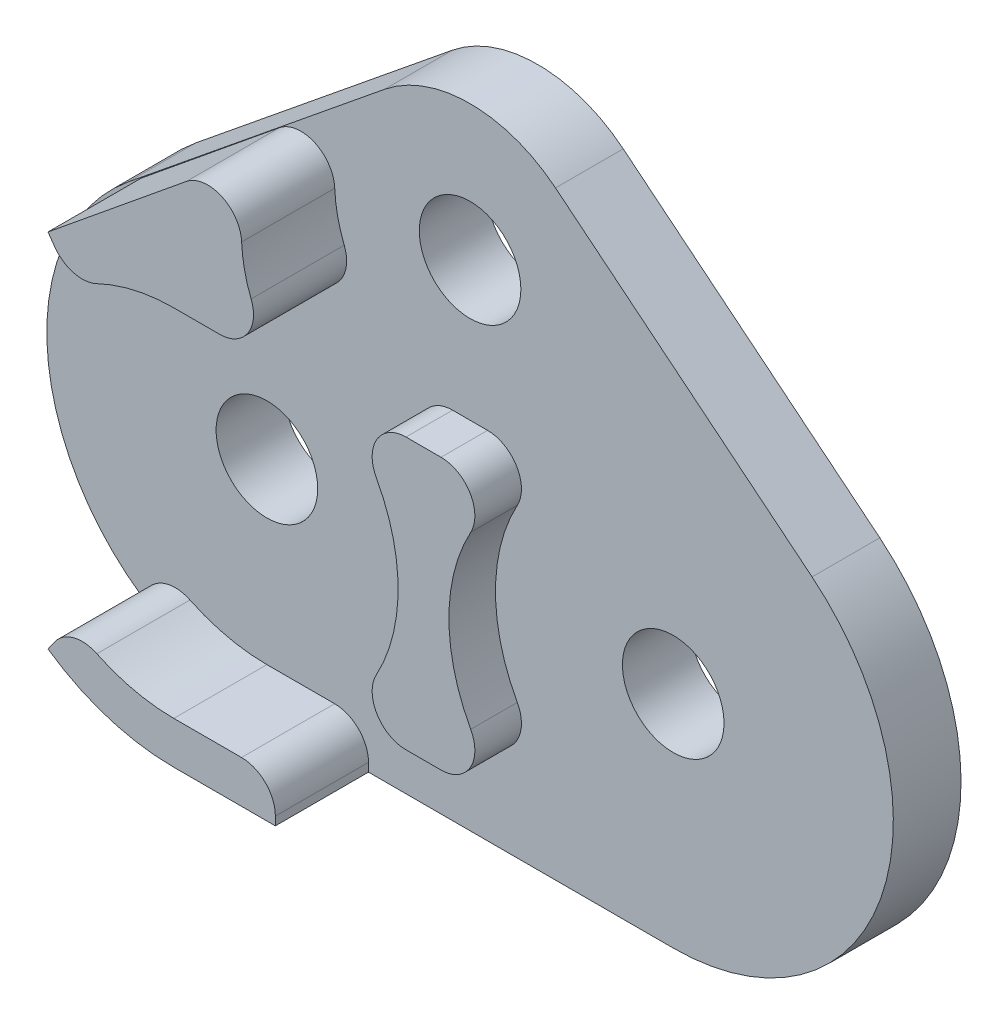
SolidWorks part; units mm, degrees
ref_plane "Front Plane" through (0, 0, 0) normal (0, 0, 1) x (1, 0, 0)
ref_plane "Top Plane" through (0, 0, 0) normal (0, 1, 0) x (1, 0, 0)
ref_plane "Right Plane" through (0, 0, 0) normal (1, 0, 0) x (0, 0, -1)
sketch "Sketch1" plane through (0, 0, 0) normal (0, 0, 1) x (1, 0, 0)
  line L0 (0, 0) -> (0, 6.801) construction
  line L1 (12.5, 0) -> (-12.5, 0) construction
  line L2 (-6, 6.5) -> (-6, -6.5) construction
  line L3 (-6, 6.5) -> (6, 6.5)
  line L4 (-6, -6.5) -> (6, -6.5)
  line L5 (6, 6.5) -> (6, -6.5) construction
  arc A0 (-6, 6.5) -> (-6, -6.5) centre (-6, 0) ccw
  arc A1 (6, 6.5) -> (6, -6.5) centre (6, 0) cw
  point P9 (0, 6.5)
  point P13 (0, -6.5)
  dimension "D2" = 6.5
  dimension "D1" = 12.5
  dimension "D3" = 6.5
extrude "Base" add sketch "Sketch1" along normal blind 2
sketch "Sketch2" plane through (0, 0, 2) normal (0, 0, 1) x (1, 0, 0)
  line L0 (-12.5, 0) -> (12.5, 0) construction
  line L1 (-6, 6.5) -> (-6, -6.5) construction
  line L2 (6, 6.5) -> (6, -6.5) construction
  arc A0 (-6, 6.5) -> (-6, -6.5) centre (-6, 0) ccw construction
  arc A1 (6, -6.5) -> (6, 6.5) centre (6, 0) ccw construction
  circle A2 centre (-6, 0) radius 1.5
  circle A3 centre (6, 0) radius 1.5
  dimension "D1" = 3
extrude "Pulley Pins" cut sketch "Sketch2" against normal through all
sketch "Sketch3" plane through (0, 0, 2) normal (0, 0, 1) x (1, 0, 0)
  line L0 (0, 6.5) -> (0, 9.7) construction
  line L1 (6, 6.5) -> (-6, 6.5) construction
  line L2 (-6, 6.5) -> (0, 6.5)
  line L3 (-2.5233, 11.2037) -> (-10.1004, 5.0435)
  line L4 (2.5233, 11.2037) -> (10.1004, 5.0435)
  line L5 (0, 6.5) -> (6, 6.5)
  circle A0 centre (0, 8.1) radius 1.5
  arc A1 (-2.5233, 11.2037) -> (2.5233, 11.2037) centre (0, 8.1) cw
  arc A2 (-6, 6.5) -> (-6, -6.5) centre (-6, 0) ccw construction
  arc A3 (-6, 6.5) -> (-10.1004, 5.0435) centre (-6, 0) ccw
  arc A4 (6, 6.5) -> (10.1004, 5.0435) centre (6, 0) cw
  circle A5 centre (6, 0) radius 1.5 construction
  dimension "D2" = 3
  dimension "D3" = 4
  dimension "D1" = 8.1
extrude "Attachment Pin" add sketch "Sketch3" against normal up to surface (2 mm away)
sketch "Sketch4" plane through (0, 0, 2) normal (0, 0, 1) x (1, 0, 0)
  line L0 (-6, 0) -> (6, 0) construction
  line L1 (0, 8.1) -> (0, 0) construction
  line L2 (-6, 0) -> (-6, 5.25) construction
  line L5 (-6, 5.25) -> (-2.8067, 5.25)
  line L6 (-6, 0) -> (-9, 4.3084) construction
  line L7 (-9, 4.3084) -> (-9.7143, 5.3342)
  line L8 (-6, -5.25) -> (-3, -5.25)
  line L9 (-3, -5.25) -> (-3, -6.5)
  line L10 (-6, -6.5) -> (6, -6.5) construction
  line L11 (-3, -6.5) -> (-6, -6.5)
  line L12 (-6, 0) -> (-9, -4.3084) construction
  line L13 (-9, -4.3084) -> (-9.7143, -5.3342)
  line L14 (-9.7143, 5.3342) -> (-2.5233, 11.2037)
  arc A0 (-6, 5.25) -> (-9, 4.3084) centre (-6, 0) ccw
  circle A1 centre (0, 8.1) radius 1.5
  circle A2 centre (0, 8.1) radius 1.5 construction
  circle A4 centre (-6, 0) radius 5.25 construction
  arc A5 (-10.1004, 5.0435) -> (-6, -6.5) centre (-6, 0) ccw construction
  arc A6 (-6, -5.25) -> (-9, -4.3084) centre (-6, 0) cw
  arc A7 (-9.7143, -5.3342) -> (-6, -6.5) centre (-6, 0) ccw
  circle A8 centre (0, 8.1) radius 4 construction
  arc A10 (-2.8067, 5.25) -> (-2.5233, 11.2037) centre (0, 8.1) cw
  arc A11 (2.5233, 11.2037) -> (-2.5233, 11.2037) centre (0, 8.1) ccw construction
  dimension "D1" = 10.5
  dimension "D2" = 3
  dimension "D3" = 3
  dimension "D4" = 3
extrude "Side Extrudes" add sketch "Sketch4" along normal blind 2.75 contours L5 A10 L14 L7 A0 | L8 A6 L13 L9 M2 M3
sketch "Sketch5" plane through (0, 0, 2) normal (0, 0, 1) x (1, 0, 0)
  line L0 (-2.5996, 4) -> (2.5996, 4)
  line L1 (0, 5.6144) -> (0, 0) construction
  line L2 (0, 0) -> (12.5, 0) construction
  line L3 (-2.5996, -4) -> (2.5996, -4)
  arc A0 (-2.5996, 4) -> (-2.5996, -4) centre (-6, 0) cw
  arc A1 (2.5996, 4) -> (2.5996, -4) centre (6, 0) ccw
  circle A4 centre (-6, 0) radius 5.25 construction
  arc A5 (-9, -4.3084) -> (-6, -5.25) centre (-6, 0) ccw construction
  arc A6 (6, -6.5) -> (10.1004, 5.0435) centre (6, 0) ccw construction
  point P3 (0, 4)
  point P15 (0, -4)
  dimension "D1" = 4
extrude "Center Extrude" add sketch "Sketch5" along normal blind 1.375
fillet "Contouring" radius 1 9 edges at (-9, -4.3084, 3.375) (-9, 4.3084, 3.375) (-2.8067, 5.25, 3.375) (-2.5233, 11.2037, 3.375) (-3, -5.25, 3.375) (-2.5996, -4, 2.6875) (2.5996, -4, 2.6875) (2.5996, 4, 2.6875) (-2.5996, 4, 2.6875)
